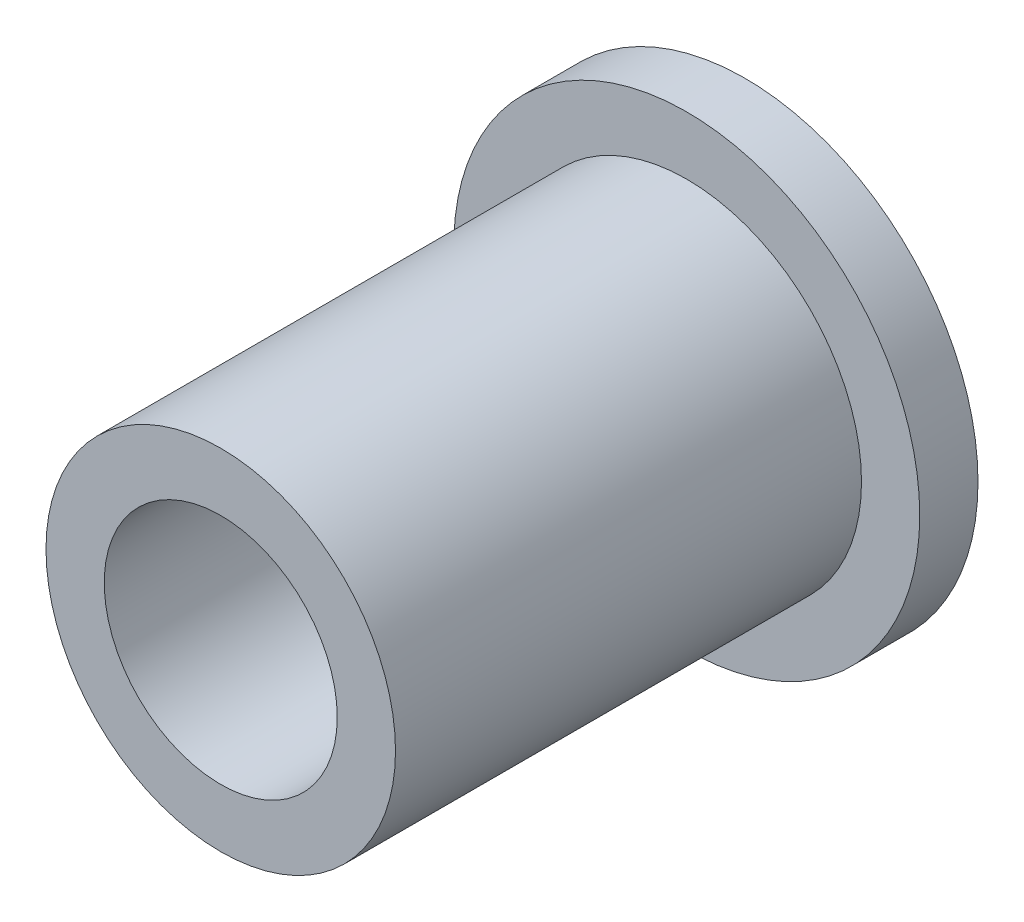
SolidWorks part; units mm, degrees
ref_plane "Front Plane" through (0, 0, 0) normal (0, 0, 1) x (1, 0, 0)
ref_plane "Top Plane" through (0, 0, 0) normal (0, 1, 0) x (1, 0, 0)
ref_plane "Right Plane" through (0, 0, 0) normal (1, 0, 0) x (0, 0, -1)
sketch "Sketch1" plane through (0, 0, 0) normal (0, 0, 1) x (1, 0, 0)
  circle A0 centre (0, 0) radius 6.35
  dimension "D1" = 12.7
extrude "Boss-Extrude1" add sketch "Sketch1" along normal blind 1.5875
sketch "Sketch2" plane through (0, 0, 1.5875) normal (0, 0, 1) x (1, 0, 0)
  circle A0 centre (0, 0) radius 4.7625
  dimension "D1" = 9.525
extrude "Boss-Extrude2" add sketch "Sketch2" along normal blind 12.7
sketch "Sketch3" plane through (0, 0, 14.2875) normal (0, 0, 1) x (1, 0, 0)
  circle A0 centre (0, 0) radius 3.175
  dimension "D1" = 6.35
extrude "Cut-Extrude1" cut sketch "Sketch3" against normal through all
